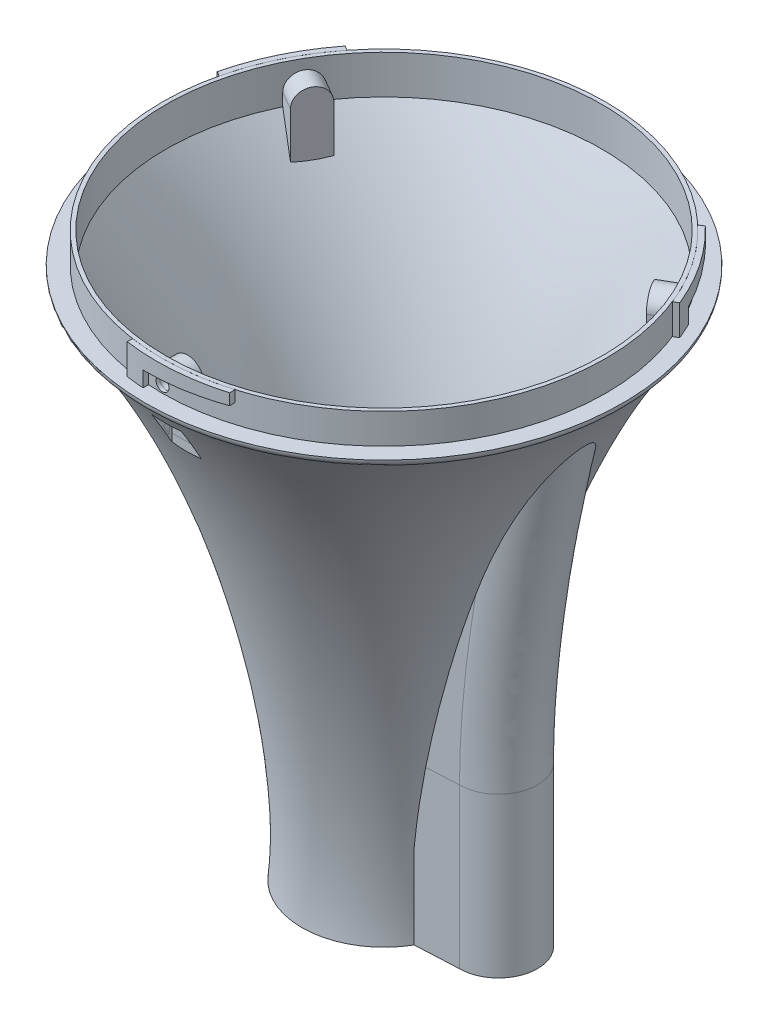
SolidWorks part; units mm, degrees
ref_plane "Alzado" through (0, 0, 0) normal (0, 0, 1) x (1, 0, 0)
ref_plane "Planta" through (0, 0, 0) normal (0, 1, 0) x (1, 0, 0)
ref_plane "Vista lateral" through (0, 0, 0) normal (1, 0, 0) x (0, 0, -1)
ref_plane "Plano2" through (0, 30, 0) normal (0, 1, 0) x (1, 0, 0)
ref_plane "Plano1" through (0, 98.8, 0) normal (0, 1, 0) x (1, 0, 0)
sketch "Croquis5" plane through (0, 0, 0) normal (0, 0, 1) x (1, 0, 0)
  line L0 (0, 98.8) -> (0, 0) construction
  line L1 (-15.5, 0) -> (-13.1752, 21.6996) construction
  line L2 (48.3977, 98.8) -> (-48.3977, 98.8) construction
  line L3 (0, 98.8) -> (-43.5, 98.8)
  line L4 (0, 0) -> (-15.5, 0)
  line L5 (-13.1752, 21.6996) -> (-22.3335, 68) construction
  line L6 (-22.3335, 68) -> (-43.5, 98.8) construction
  line L7 (0, 21.3) -> (-16, 21.3) construction
  line L8 (0, 68) -> (-27.5, 68) construction
  line L9 (0, 98.8) -> (0, 0)
  line L10 (55, 0) -> (-55, 0) construction
  spline S0 degree 3 poles (-15.5, 0) (-13.1752, 21.6996) (-22.3335, 68) (-43.5, 98.8) knots 0 0 0 0 1 1 1 1
  dimension "D1" = 43.5
  dimension "D2" = 15.5
  dimension "D3" = 21.3
  dimension "D4" = 16
  dimension "D5" = 68
  dimension "D6" = 27.5
revolve "Revolución2" add sketch "Croquis5" angle 360 about L9
sketch "Croquis6" plane through (0, 0, 0) normal (0, 1, 0) x (1, 0, 0)
  line L0 (13.4234, -7.75) -> (13.4234, 7.75)
  line L5 (13.4234, 7.75) -> (21.5734, 7.35)
  line L7 (21.5734, -7.35) -> (13.4234, -7.75)
  line L8 (28.9234, 0) -> (28.9234, 9.5386) construction
  arc A1 (21.5734, -7.35) -> (21.5734, 7.35) centre (21.5734, 0) ccw
  circle A2 centre (0, 0) radius 15.5 construction
  point P5 (13.4234, 0)
  dimension "D1" = 14.7
  dimension "D2" = 15.5
  dimension "D3" = 15.5
sketch "Croquis7" plane through (0, 0, 0) normal (0, 0, 1) x (1, 0, 0)
  line L0 (21.5734, 0) -> (21.5734, 30)
  line L1 (13.4234, 0) -> (21.5734, 0) construction
  line L2 (21.5734, 0) -> (13.4234, 0) construction
  line L3 (21.5734, 30) -> (21.5734, 55.8488) construction
  line L4 (21.5734, 55.8488) -> (31.6159, 94.8479) construction
  spline S0 degree 2 poles (21.5734, 30) (21.5734, 55.8488) (31.6159, 94.8479) knots 0 0 0 1 1 1
sweep "Barrer1" add profiles "Croquis6" path "Croquis7"
shell "Vaciado1" thickness 2
sketch "Croquis10" plane through (0, 98.8, 0) normal (0, 1, 0) x (1, 0, 0)
  circle A0 centre (0, 0) radius 41.0831
  circle A1 centre (0, 0) radius 41.8331
  dimension "D1" = 0.75
extrude "Saliente-Extruir4" add sketch "Croquis10" along normal blind 7.3
sketch "Croquis11" plane through (0, 0, 0) normal (0, 0, 1) x (1, 0, 0)
  line L0 (0, 115.6741) -> (0, 88.2596) construction
  line L1 (43.5, 98.8) -> (-43.5, 98.8) construction
  line L2 (-41.8331, 98.8) -> (-43.4331, 98.8)
  line L3 (-41.8331, 98.8) -> (-41.8331, 100.4)
  line L4 (-41.8331, 100.4) -> (-45.0331, 100.4)
  line L6 (-41.8331, 106.1) -> (-41.8331, 98.8) construction
  arc A0 (-45.0331, 100.4) -> (-43.4331, 98.8) centre (-43.4331, 100.4) ccw
  dimension "D1" = 3.2
revolve "Revolución5" add sketch "Croquis11" angle 360 about L0
sketch "Croquis12" plane through (0, 106.1, 0) normal (0, 1, 0) x (1, 0, 0)
  line L0 (0, 0) -> (0, -69.5155) construction
  line L1 (-36.7789, -41.0831) -> (44.1746, -41.0831) construction
  line L2 (-41.4026, -36.5831) -> (50.1305, -36.5831) construction
  circle A0 centre (0, 0) radius 41.0831 construction
  dimension "D1" = 4.5
ref_plane "Plano3" through (0, 0, 37) normal (0, 0, 1) x (1, 0, 0)
sketch "Croquis13" plane through (0, 0, 37) normal (0, 0, 1) x (1, 0, 0)
  line L0 (-3, 104.2) -> (3, 104.2) construction
  line L1 (3, 90.2) -> (-3, 90.2)
  line L2 (3, 90.2) -> (3, 101.2)
  line L4 (-3, 90.2) -> (-3, 101.2)
  line L7 (-36.7789, 106.1) -> (44.1746, 106.1) construction
  arc A0 (3, 101.2) -> (-3, 101.2) centre (0, 101.2) ccw
  point P0 (0, 97.2)
  dimension "D1" = 14
  dimension "D2" = 6
  dimension "D3" = 1.9
  dimension "D4" = 4
extrude "Saliente-Extruir5" add sketch "Croquis13" along normal blind 4.2 separate body
sketch "Croquis16" plane through (-3, 0, 0) normal (-1, 0, 0) x (0, 0, 1)
  line L0 (41.2, 96.996) -> (37.7402, 90.2)
  line L1 (41.2, 101.2) -> (41.2, 90.2) construction
  line L2 (41.2, 90.2) -> (37, 90.2) construction
surface "Superficie-Extruir1" sketch "Croquis16" parameters "D1"=6
other "Cortar con superficie1"
ref_plane "Plano4" through (0, 77, 0) normal (0, 1, 0) x (1, 0, 0)
sketch "Croquis17" plane through (0, 77, 0) normal (0, 1, 0) x (1, 0, 0)
  line L18 (2.8, -37.2) -> (-2.8, -37.2)
  line L19 (-2.8, -37.2) -> (-2.8, -41)
  line L20 (-2.8, -41) -> (2.8, -41)
  line L21 (2.8, -41) -> (2.8, -37.2)
  line L22 (2.8, -37.2) -> (-2.8, -37.2)
  line L23 (-2.8, -37.2) -> (-2.8, -41)
  line L24 (-2.8, -41) -> (2.8, -41)
  line L25 (2.8, -41) -> (2.8, -37.2)
  dimension "D1" = 0.2
extrude "Cortar-Extruir2" cut sketch "Croquis17" along normal blind 20
pattern_circular "MatrizC1" count 3 over 360 about axis through (0, 0, 0) along (0, 1, 0)
pattern_circular "MatrizC2" count 3 over 360 about axis through (0, 0, 0) along (0, 1, 0) of "Cortar-Extruir2"
ref_plane "Plano5" through (0, 0, 43) normal (0, 0, 1) x (1, 0, 0)
sketch "Croquis19" plane through (0, 0, 43) normal (0, 0, 1) x (1, 0, 0)
  line L0 (45.0331, 100.4) -> (-45.0331, 100.4) construction
  circle A0 centre (0.0596, 101.9) radius 1.225
  dimension "D1" = 2.45
  dimension "D2" = 1.5
extrude "Cortar-Extruir3" cut sketch "Croquis19" against normal blind 4
pattern_circular "MatrizC3" count 3 over 360 about axis through (0, 0, 0) along (0, 1, 0) of "Cortar-Extruir3"
sketch "Croquis20" plane through (0, 106.1, 0) normal (0, 1, 0) x (1, 0, 0)
  line L0 (3, -37) -> (-3, -37) construction
  line L2 (-6, -41.4006) -> (-6, -42.4077)
  line L4 (12, -40.0751) -> (12, -41.1146)
  arc A0 (-6, -42.4077) -> (12, -41.1146) centre (0, 0) ccw
  arc A1 (-6, -41.4006) -> (12, -40.0751) centre (0, 0) ccw
  point P10 (0, -37)
  dimension "D2" = 6
extrude "Saliente-Extruir6" add sketch "Croquis20" against normal blind 5.75 separate body
sketch "Croquis21" plane through (0, 0, 43) normal (0, 0, 1) x (1, 0, 0)
  line L0 (-6, 100.35) -> (-2.67, 100.35) construction
  line L1 (-6, 100.35) -> (12, 100.35) construction
  line L2 (-2.67, 100.35) -> (-2.67, 103.3)
  line L3 (-2.67, 103.3) -> (12, 104)
  line L4 (12, 100.35) -> (12, 106.1) construction
  line L7 (12, 106.1) -> (-6, 106.1) construction
  dimension "D1" = 3.33
  dimension "D2" = 2.8
  dimension "D3" = 2.1
surface "Superficie-Extruir2" sketch "Croquis21" parameters "D1"=8.5
other "Cortar con superficie2"
pattern_circular "MatrizC5" count 3 over 360 about axis through (0, 0, 0) along (0, 1, 0)
